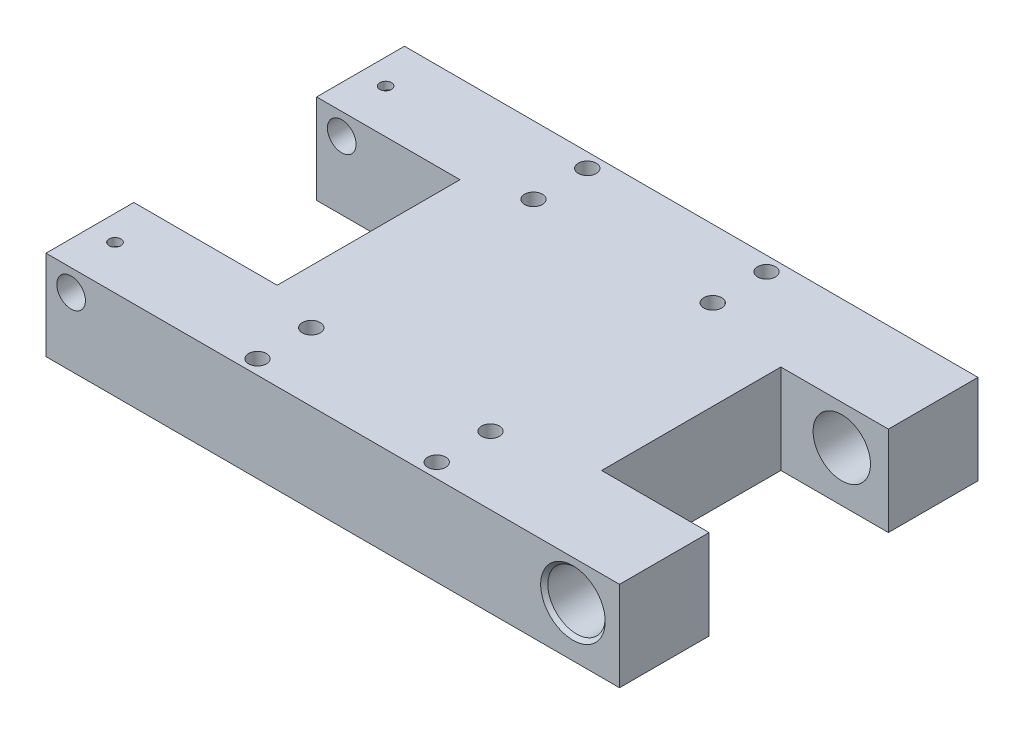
SolidWorks part; units mm, degrees
ref_plane "Face" through (0, 0, 0) normal (0, 0, 1) x (1, 0, 0)
ref_plane "Dessus" through (0, 0, 0) normal (0, 1, 0) x (1, 0, 0)
ref_plane "Droite" through (0, 0, 0) normal (1, 0, 0) x (0, 0, -1)
sketch "Esquisse1" plane through (0, 0, 0) normal (0, 0, 1) x (1, 0, 0)
  line L0 (-80, 12.5) -> (80, -12.5) construction
  line L1 (-80, 12.5) -> (80, 12.5)
  line L2 (-80, 12.5) -> (-80, -12.5)
  line L3 (-80, -12.5) -> (80, -12.5)
  line L4 (80, 12.5) -> (80, -12.5)
  dimension "D1" = 25
  dimension "D2" = 160
extrude "Extrusion1" add sketch "Esquisse1" along normal mid plane 100
sketch "Esquisse2" plane through (0, 0, 50) normal (0, 0, 1) x (1, 0, 0)
  line L0 (80, 12.5) -> (-80, 12.5) construction
  line L2 (67, 1.5) -> (67, -25.2882) construction
  line L3 (-73, 6.5) -> (-73, 25.0035) construction
  line L5 (80, -12.5) -> (80, 12.5) construction
  circle A0 centre (-73, 6.5) radius 4
  circle A1 centre (67, 1.5) radius 8
  dimension "D1" = 8
  dimension "D2" = 5
  dimension "D3" = 16
  dimension "D4" = 2
  dimension "D5" = 140
  dimension "D6" = 5
extrude "Enlèv. mat.-Extru.5" cut sketch "Esquisse2" against normal through all
sketch "Esquisse3" plane through (0, 12.5, 0) normal (0, 1, 0) x (-1, 0, 0)
  line L0 (80, 50) -> (80, -50) construction
  line L1 (90, -25.5) -> (40, -25.5)
  line L2 (90, -25.5) -> (90, 25.5)
  line L3 (90, 25.5) -> (40, 25.5)
  line L4 (40, -25.5) -> (40, 25.5)
  line L5 (-90, -25) -> (-50, -25)
  line L6 (-90, -25) -> (-90, 25)
  line L7 (-90, 25) -> (-50, 25)
  line L8 (-50, -25) -> (-50, 25)
  line L9 (40, 0) -> (0, 0) construction
  line L10 (-80, 50) -> (-80, -50) construction
  line L11 (-50, 0) -> (0, 0) construction
  dimension "D1" = 10
  dimension "D2" = 51
  dimension "D3" = 40
  dimension "D4" = 10
  dimension "D5" = 50
  dimension "D6" = 30
extrude "Enlèv. mat.-Extru.6" cut sketch "Esquisse3" against normal through all
hole_wizard "Trou taraudé M4x0.71" positions "Esquisse12" profile "Esquisse11" tap size "M4x0.7" standard "ISO"
sketch "Esquisse12" plane through (0, 12.5, 0) normal (0, 1, 0) x (-1, 0, 0)
  line L0 (73, -50) -> (73, -25.5) construction
  line L3 (73, 25.5) -> (73, 50) construction
  point P0 (73, -37.75)
  point P1 (73, 37.75)
sketch "Esquisse11" plane through (-73, 12.5, -37.75) normal (1, 0, 0) x (0, 0, 1)
  line L0 (0, 0) -> (0, 11.0914)
  line L1 (0, 11.0914) -> (1.65, 10.1)
  line L2 (1.65, 10.1) -> (1.65, 0)
  line L5 (1.65, 0) -> (0, 0)
  line L10 (0, 11.0914) -> (-1.65, 10.1) construction
  line L11 (0, -6.35) -> (0, 107.95) construction
  dimension "Diamètre du trou pour taraudage" = 3.3
  dimension "Profondeur du trou pour taraudage" = 10.1
  dimension "Angle de pointe" = 118
hole_wizard "Trou taraudé M6x1.01" positions "Esquisse14" profile "Esquisse13" tap size "M6x1.0" standard "ISO"
sketch "Esquisse14" plane through (0, -12.5, 0) normal (0, -1, 0) x (1, 0, 0)
  line L0 (0, 50) -> (0, 46) construction
  line L1 (-25, 46) -> (25, 46) construction
  line L2 (-25, 46) -> (-25, 31) construction
  line L3 (-25, 31) -> (25, 31) construction
  line L4 (25, 46) -> (25, 31) construction
  line L6 (-80, 50) -> (80, 50) construction
  point P1 (25, 31)
  point P2 (25, 46)
  point P3 (-25, 46)
  point P4 (-25, 31)
  dimension "D1" = 15
  dimension "D2" = 50
  dimension "D3" = 4
sketch "Esquisse13" plane through (25, -12.5, 31) normal (1, 0, 0) x (0, 0, -1)
  line L0 (0, 0) -> (0, 25)
  line L1 (0, 25) -> (2.5, 25)
  line L2 (2.5, 25) -> (2.5, 0)
  line L5 (2.5, 0) -> (0, 0)
  line L11 (0, -6.35) -> (0, 107.95) construction
  dimension "Diamètre du trou pour taraudage jusqu'au prochain" = 5
  dimension "Profondeur du trou pour taraudage jusqu'au prochain" = 25
chamfer "Chanfrein1" distance 1 angle 45 2 edges at (75, 1.5, -50) (75, 1.5, 50)
mirror "Symétrie1" about plane through (0, 0, 0) normal (0, 0, 1) of "Trou taraudé M6x1.01"
